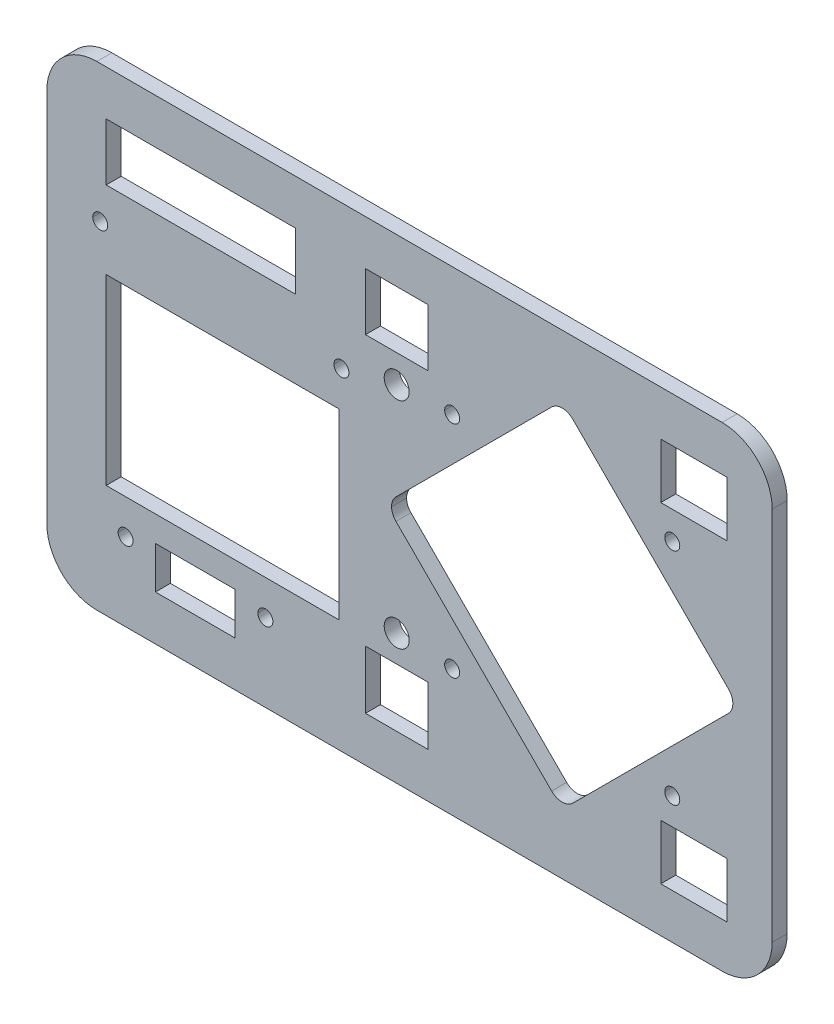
SolidWorks part; units mm, degrees
ref_plane "Front Plane" through (0, 0, 0) normal (0, 0, 1) x (1, 0, 0)
ref_plane "Top Plane" through (0, 0, 0) normal (0, 1, 0) x (1, 0, 0)
ref_plane "Right Plane" through (0, 0, 0) normal (1, 0, 0) x (0, 0, -1)
imported_body "Imported1"
sketch "Sketch1" plane through (0, 0, 0) normal (0, 0, 1) x (1, 0, 0)
  line L1 (211.81, -24.4) -> (198.5453, -24.4)
  line L2 (211.81, -24.4) -> (211.81, -35.4)
  line L3 (211.81, -35.4) -> (198.5453, -35.4)
  line L4 (198.5453, -24.4) -> (198.5453, -35.4)
  line L5 (211.81, -101.4) -> (198.5453, -101.4)
  line L6 (211.81, -101.4) -> (211.81, -90.4)
  line L7 (211.81, -90.4) -> (198.5453, -90.4)
  line L8 (198.5453, -101.4) -> (198.5453, -90.4)
  line L9 (139.5142, -101.4) -> (152.0016, -101.4)
  line L10 (139.5142, -101.4) -> (139.5142, -89.7642)
  line L11 (139.5142, -89.7642) -> (152.0016, -89.7642)
  line L12 (152.0016, -101.4) -> (152.0016, -89.7642)
  line L13 (139.5142, -24.4) -> (152.0016, -24.4)
  line L14 (139.5142, -24.4) -> (139.5142, -35.8417)
  line L15 (139.5142, -35.8417) -> (152.0016, -35.8417)
  line L16 (152.0016, -24.4) -> (152.0016, -35.8417)
  line L17 (134.2166, -51.3562) -> (87.6729, -51.3562)
  line L18 (134.2166, -51.3562) -> (134.2166, -87.8722)
  line L19 (134.2166, -87.8722) -> (87.6729, -87.8722)
  line L20 (87.6729, -51.3562) -> (87.6729, -87.8722)
  line L21 (125.5133, -24.4) -> (87.6729, -24.4)
  line L22 (125.5133, -24.4) -> (125.5133, -35.8417)
  line L23 (125.5133, -35.8417) -> (87.6729, -35.8417)
  line L24 (87.6729, -24.4) -> (87.6729, -35.8417)
  line L25 (97.5114, -92.9807) -> (113.4043, -92.9807)
  line L26 (97.5114, -92.9807) -> (97.5114, -101.4)
  line L27 (97.5114, -101.4) -> (113.4043, -101.4)
  line L28 (113.4043, -92.9807) -> (113.4043, -101.4)
  circle A0 centre (145.7579, -41.4) radius 2.5
  circle A1 centre (145.7579, -84.4) radius 2.5
extrude "Cut-Extrude1" cut sketch "Sketch1" along normal blind 3
